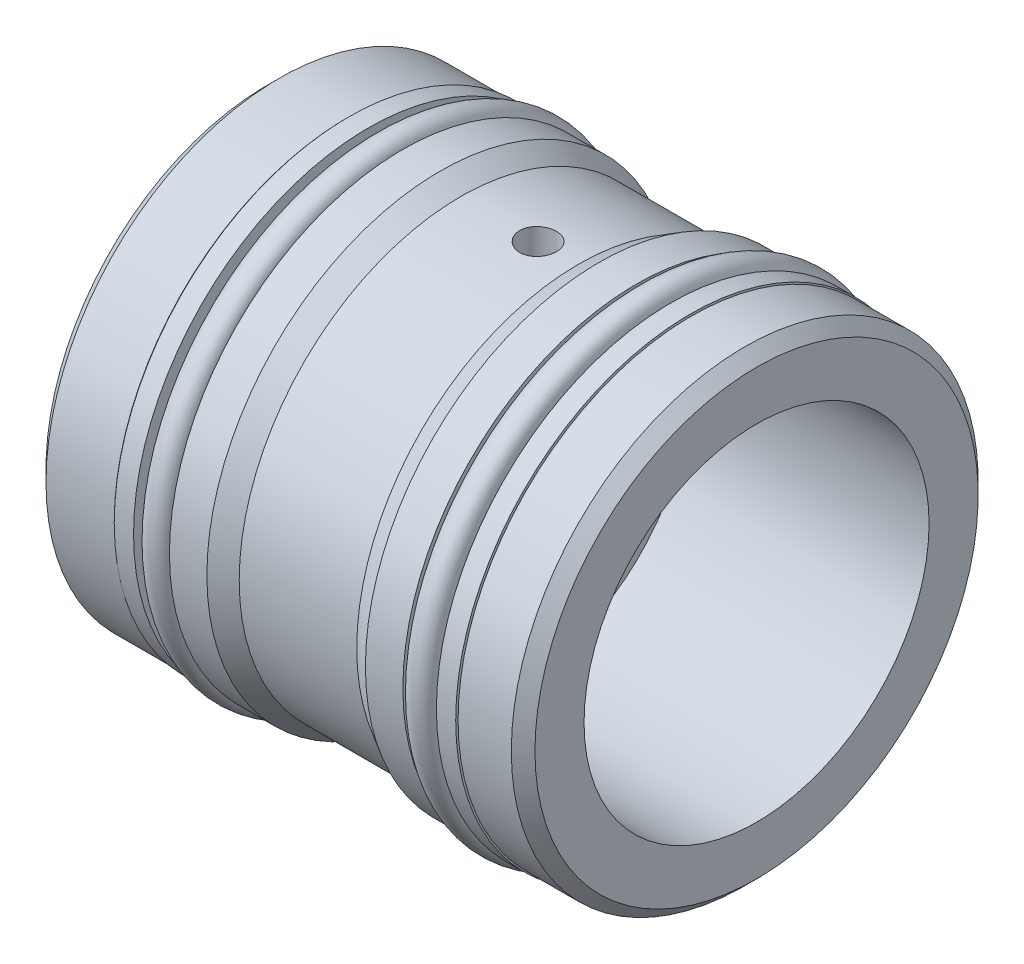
SolidWorks part; units mm, degrees
ref_plane "Front Plane" through (0, 0, 0) normal (0, 0, 1) x (1, 0, 0)
ref_plane "Top Plane" through (0, 0, 0) normal (0, 1, 0) x (1, 0, 0)
ref_plane "Right Plane" through (0, 0, 0) normal (1, 0, 0) x (0, 0, -1)
sketch "Sketch1" plane through (0, 0, 0) normal (0, 0, 1) x (1, 0, 0)
  line L0 (0, 0) -> (0, 45.5562) construction
  line L1 (0, 0) -> (32.8567, 0) construction
  line L2 (-15.748, 6.35) -> (-15.748, 15.0368)
  line L3 (-15.748, 15.0368) -> (-10.5918, 15.0368)
  line L4 (-10.5918, 15.0368) -> (-10.5918, 13.7668)
  line L5 (-10.5918, 13.7668) -> (-7.0358, 13.7668)
  line L6 (-7.0358, 13.7668) -> (-7.0358, 15.0368)
  line L7 (-7.0358, 15.0368) -> (-4.6228, 15.0368)
  line L8 (-4.6228, 15.0368) -> (-4.6228, 14.2748)
  line L9 (-4.6228, 14.2748) -> (5.588, 14.2748)
  line L10 (-15.748, 6.35) -> (0.3556, 6.35)
  line L11 (0.3556, 6.35) -> (0.3556, 11.1125)
  line L12 (0.3556, 11.1125) -> (15.748, 11.1125)
  line L13 (5.588, 15.0368) -> (5.588, 14.2748)
  line L14 (8.001, 15.0368) -> (5.588, 15.0368)
  line L15 (8.001, 13.7668) -> (8.001, 15.0368)
  line L16 (11.557, 13.7668) -> (8.001, 13.7668)
  line L17 (11.557, 15.0368) -> (11.557, 13.7668)
  line L18 (15.748, 15.0368) -> (11.557, 15.0368)
  line L19 (15.748, 15.0368) -> (15.748, 11.1125)
  dimension "D2" = 3.556
  dimension "D3" = 10.2108
  dimension "D4" = 30.0736
  dimension "D5" = 31.496
  dimension "D6" = 22.225
  dimension "D7" = 15.3924
  dimension "D8" = 28.5496
  dimension "D9" = 27.5336
  dimension "D10" = 12.7
  dimension "D11" = 26.3398
  dimension "D12" = 2.413
  dimension "D13" = 2.413
revolve "Revolve1" add sketch "Sketch1" angle 360 about L1
fillet "Fillet1" radius 0.381 2 edges at (5.588, 0, 14.2748) (-4.6228, 0, 14.2748)
chamfer "Chamfer1" distance 0.762 angle 45 2 edges at (15.748, 0, 15.0368) (-15.748, 0, 15.0368)
sketch "Sketch6" plane through (0, 0, 0) normal (0, 0, 1) x (1, 0, 0)
  line L0 (0, 0) -> (49.5791, 0) construction
  line L1 (-15.748, 14.2748) -> (-15.748, -14.2748) construction
  line L2 (-7.0358, 13.7668) -> (-10.5918, 13.7668) construction
  line L3 (-10.5156, 13.7668) -> (-9.271, 13.7668)
  line L4 (-10.5156, 13.7668) -> (-10.5156, 15.113)
  line L5 (-10.5156, 15.113) -> (-9.271, 15.113)
  line L6 (-9.271, 13.7668) -> (-9.271, 15.113)
  line L7 (0.4826, 41.4439) -> (0.4826, -9.3524) construction
  line L8 (-10.5918, -15.0368) -> (-10.5918, 15.0368) construction
  line L9 (11.557, 13.7668) -> (11.557, -13.7668) construction
  line L10 (-7.0358, 15.0368) -> (-7.0358, -15.0368) construction
  line L11 (10.2362, 13.7668) -> (10.2362, 15.113)
  line L12 (11.4808, 15.113) -> (10.2362, 15.113)
  line L13 (11.4808, 13.7668) -> (11.4808, 15.113)
  line L14 (11.4808, 13.7668) -> (10.2362, 13.7668)
  circle A0 centre (-8.001, 14.5796) radius 0.889
  circle A1 centre (8.9662, 14.5796) radius 0.889
  dimension "D4" = 1.778
  dimension "D5" = 29.1592
  dimension "D6" = 0.9652
  dimension "D1" = 1.2446
  dimension "D2" = 5.2324
  dimension "D3" = 30.226
revolve "Revolve3" add sketch "Sketch6" angle 360 about L0
sketch "Sketch7" plane through (0, 0, 0) normal (0, 1, 0) x (0, 0, -1)
  line L1 (-14.2748, -15.748) -> (14.2748, -15.748) construction
  circle A0 centre (0, -1.6764) radius 1.1811
  dimension "D1" = 2.3622
  dimension "D2" = 14.0716
extrude "Cut-Extrude1" cut sketch "Sketch7" against normal through all and the other way through all
sketch "Sketch8" plane through (0, 0, 0) normal (0, 0, 1) x (1, 0, 0)
  line L0 (-4.6228, 15.0368) -> (-3.303, 14.2748)
  line L1 (-4.6228, -15.0368) -> (-4.6228, 15.0368) construction
  line L2 (0.4953, 14.2748) -> (-4.2418, 14.2748) construction
  line L3 (-3.303, 14.2748) -> (-4.6228, 14.2748)
  line L4 (-4.6228, 14.2748) -> (-4.6228, 15.0368)
  line L5 (-4.6228, 15.0368) -> (-7.0358, 15.0368) construction
  line L6 (0, 0) -> (20.0294, 0) construction
  line L7 (0.4826, 18.4062) -> (0.4826, 8.0776) construction
  line L8 (5.588, 14.6558) -> (5.588, -14.6558) construction
  line L9 (5.588, 14.2748) -> (5.588, 15.0368)
  line L10 (4.2682, 14.2748) -> (5.588, 14.2748)
  line L11 (5.588, 15.0368) -> (4.2682, 14.2748)
  dimension "D1" = 30
revolve "Revolve4" add sketch "Sketch8" angle 360 about L6
